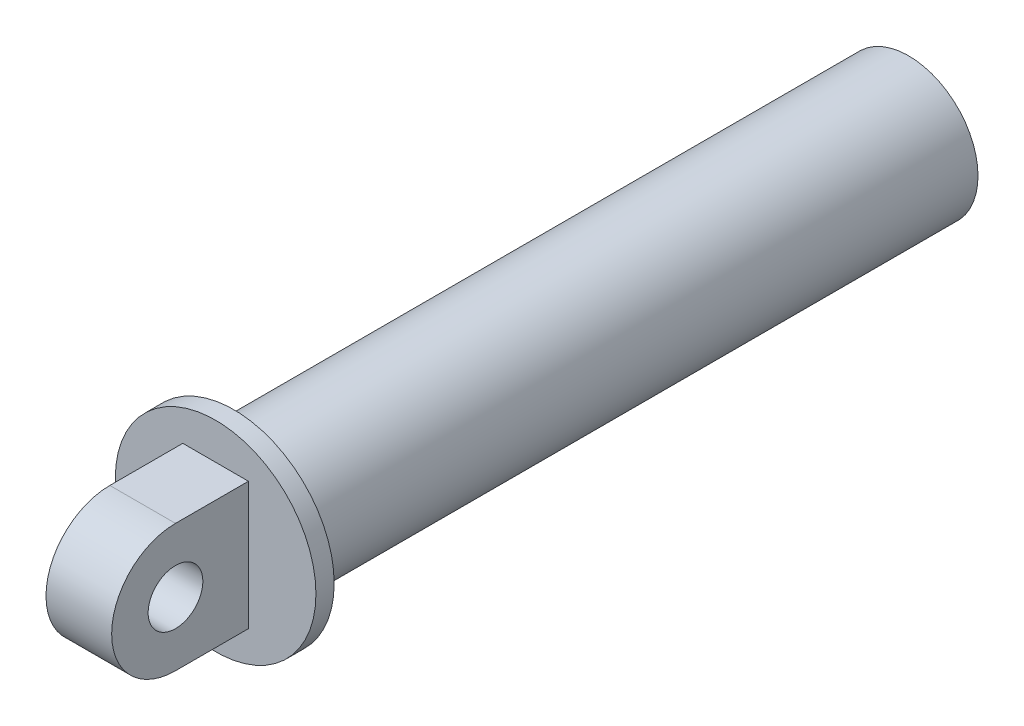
SolidWorks part; units mm, degrees
ref_plane "前视基准面" through (0, 0, 0) normal (0, 0, 1) x (1, 0, 0)
ref_plane "上视基准面" through (0, 0, 0) normal (0, 1, 0) x (1, 0, 0)
ref_plane "右视基准面" through (0, 0, 0) normal (1, 0, 0) x (0, 0, -1)
sketch "草图1" plane through (0, 0, 0) normal (0, 0, 1) x (1, 0, 0)
  circle A0 centre (0, 0) radius 38
  circle A1 centre (0, 0) radius 30
  dimension "D1" = 76
  dimension "D2" = 60
extrude "拉伸1" add sketch "草图1" along normal blind 370
sketch "草图2" plane through (0, 0, 370) normal (0, 0, 1) x (1, 0, 0)
  circle A0 centre (0, 0) radius 55
  dimension "D1" = 110
extrude "拉伸2" add sketch "草图2" along normal blind 10
sketch "草图3" plane through (0, 0, 0) normal (1, 0, 0) x (0, 0, -1)
  line L0 (-579.2449, 0) -> (-300.5224, 0) construction
  line L1 (-380, 55) -> (-380, -55) construction
  line L2 (-420, 35) -> (-380, 35)
  line L3 (-380, 35) -> (-380, -35)
  line L4 (-380, -35) -> (-420, -35)
  circle A0 centre (-420, 0) radius 15
  arc A1 (-420, 35) -> (-420, -35) centre (-420, 0) ccw
  dimension "D1" = 35
  dimension "D2" = 40
  dimension "D3" = 30
extrude "拉伸3" add sketch "草图3" along normal mid plane 36
sketch "草图4" plane through (0, 0, 370) normal (0, 0, -1) x (-1, 0, 0)
  circle A1 centre (0, 0) radius 30
  circle A2 centre (0, 0) radius 30
  dimension "D1" = 0
extrude "拉伸4" add sketch "草图4" along normal blind 20
